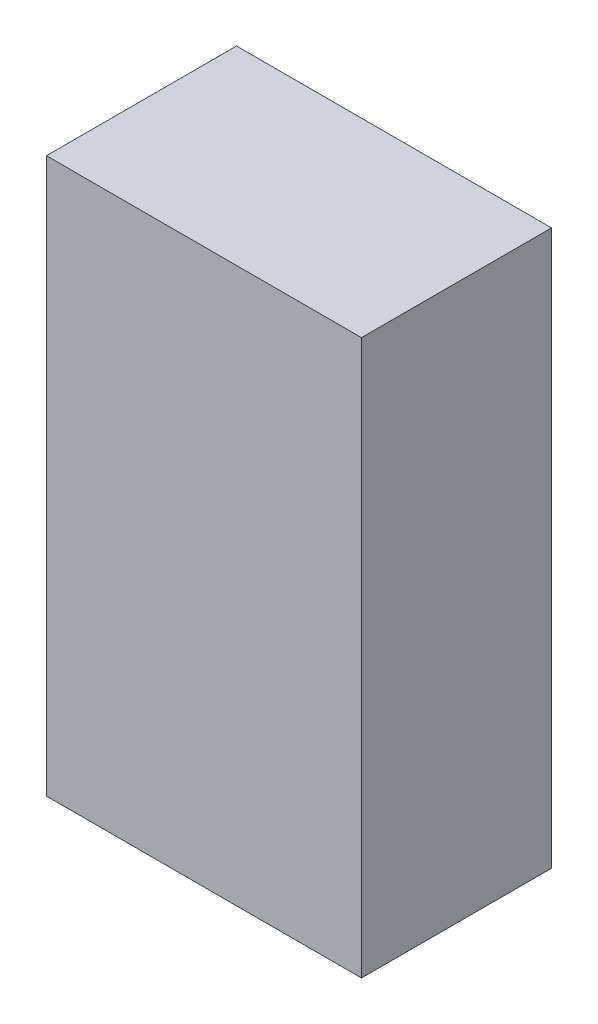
SolidWorks part; units mm, degrees
ref_plane "Front Plane" through (0, 0, 0) normal (0, 0, 1) x (1, 0, 0)
ref_plane "Top Plane" through (0, 0, 0) normal (0, 1, 0) x (1, 0, 0)
ref_plane "Right Plane" through (0, 0, 0) normal (1, 0, 0) x (0, 0, -1)
sketch "Sketch1" plane through (0, 0, 0) normal (0, 0, 1) x (1, 0, 0)
  line L0 (15.367, 27.051) -> (-15.367, -27.051) construction
  line L1 (-15.367, -27.051) -> (15.367, -27.051)
  line L2 (-15.367, -27.051) -> (-15.367, 27.051)
  line L3 (-15.367, 27.051) -> (15.367, 27.051)
  line L4 (15.367, -27.051) -> (15.367, 27.051)
  point P4 (0, 0)
  dimension "D1" = 54.102
  dimension "D2" = 30.734
extrude "Boss-Extrude1" add sketch "Sketch1" along normal blind 18.542
